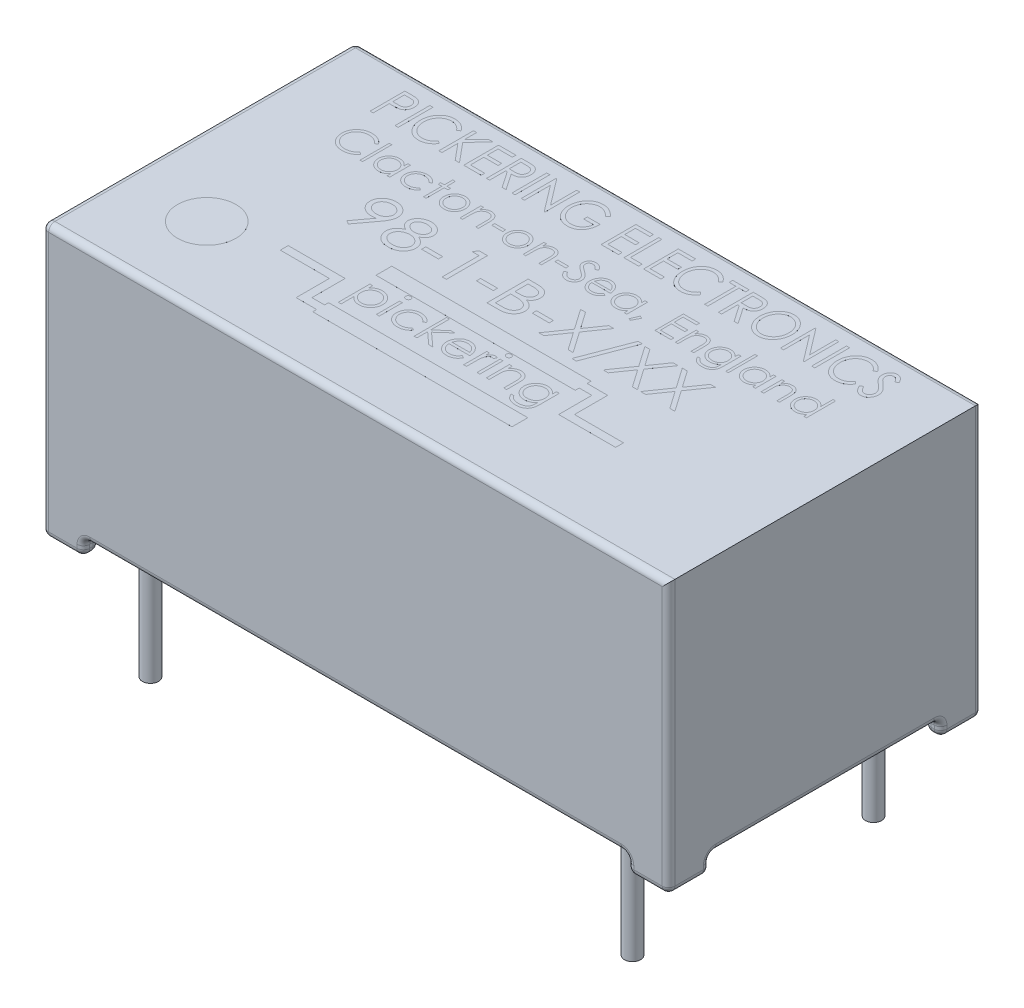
SolidWorks part; units mm, degrees
ref_plane "Front Plane" through (0, 0, 0) normal (0, 0, 1) x (1, 0, 0)
ref_plane "Top Plane" through (0, 0, 0) normal (0, 1, 0) x (1, 0, 0)
ref_plane "Right Plane" through (0, 0, 0) normal (1, 0, 0) x (0, 0, -1)
sketch "Sketch1" plane through (0, 0, 0) normal (0, 1, 0) x (1, 0, 0)
  line L1 (9.9, -4.95) -> (-9.9, -4.95)
  line L2 (9.9, -4.95) -> (9.9, 4.95)
  line L3 (9.9, 4.95) -> (-9.9, 4.95)
  line L4 (-9.9, -4.95) -> (-9.9, 4.95)
  line L5 (9.9, -4.95) -> (-9.9, 4.95) construction
  line L6 (9.9, 4.95) -> (-9.9, -4.95) construction
  point P0 (0, 0)
  dimension "D1" = 9.9
  dimension "D2" = 19.8
extrude "Main Body" add sketch "Sketch1" along normal blind 8.092
sketch "Sketch2" plane through (0, 0, 0) normal (0, -1, 0) x (1, 0, 0)
  line L1 (-9.9, 4.95) -> (-8.6, 4.95)
  line L2 (-9.9, 4.95) -> (-9.9, 3.65)
  line L3 (-9.9, 3.65) -> (-9.4, 3.65)
  line L4 (-8.6, 4.95) -> (-8.6, 4.45)
  line L7 (-8.6, 4.45) -> (-9.4, 4.45)
  line L8 (-9.4, 3.65) -> (-9.4, 4.45)
  dimension "D1" = 1.3
  dimension "D2" = 1.3
  dimension "D3" = 0.5
  dimension "D4" = 0.5
extrude "Foot" add sketch "Sketch2" along normal blind 0.508
mirror "Mirror1" about plane through (0, 0, 0) normal (0, 0, 1) of "Foot"
mirror "Mirror2" about plane through (0, 0, 0) normal (1, 0, 0) of "Mirror1", "Foot"
sketch "Sketch3"
  dimension "D1" = 11.5
  dimension "D2" = 4.15
  dimension "D3" = 1.7
  dimension "D4" = 1.5
  dimension "D5" = 1.9
extrude "Lettering" add sketch "Sketch3" along normal blind 0.0001
sketch "Sketch4"
  dimension "D7" = 1.85
  dimension "D1" = 0.5
  dimension "D2" = 6.3
  dimension "D3" = 6.75
  dimension "D4" = 0.5
  dimension "D5" = 1.5
  dimension "D6" = 1.8
  dimension "D8" = 2.6
  dimension "D9" = 2.6
  dimension "D10" = 0.65
  dimension "D11" = 0.25
  dimension "D12" = 0.25
  dimension "D13" = 1.3
  dimension "D14" = 0.25
  dimension "D15" = 1.8
  dimension "D16" = 0.125
  dimension "D17" = 0.65
  dimension "D18" = 0.125
  dimension "D19" = 0.25
  dimension "D20" = 0.25
  dimension "D21" = 1.3
  dimension "D22" = 0.25
  dimension "D23" = 1.8
extrude "Pickering logo" add sketch "Sketch4" along normal blind 0.0001
sketch "Sketch5" plane through (0, 0, 0) normal (0, -1, 0) x (1, 0, 0)
  line L0 (-8.6, 4.95) -> (8.6, 4.95) construction
  line L2 (-9.9, -3.65) -> (-9.9, 3.65) construction
  circle A0 centre (-7.62, 3.81) radius 0.254
  circle A1 centre (-7.62, -3.81) radius 0.254
  circle A2 centre (-5.08, -3.81) radius 0.254
  dimension "D1" = 0.508
  dimension "D2" = 1.14
  dimension "D3" = 2.28
  dimension "D4" = 2.54
extrude "Pins Left" add sketch "Sketch5" along normal blind 3.808
mirror "Pins Right" about plane through (0, 0, 0) normal (1, 0, 0) of "Pins Left"
fillet "Fillet1" radius 0.2 67 edges at (-9.4, 0, -4.05) (-9, 0, -4.45) (-9, 0, 4.45) (9, 0, 4.45) (9, 0, -4.45) (9.4, 0, -4.05) (9.4, 0, 4.05) (-9.4, 0, 4.05) (-9.4, -0.508, -4.05) (-9, -0.508, -4.45) (-9.9, -0.508, -4.3) (-9.4, -0.254, -3.65) (-9.65, -0.508, -3.65) (-9.9, -0.254, -3.65) (-9.65, 0, -3.65) (-8.6, -0.508, -4.7) (-8.6, -0.254, -4.45) (-8.6, 0, -4.7) (-8.6, -0.254, 4.45) (8.6, -0.254, 4.45) (8.6, 0, 4.7) (8.6, -0.254, -4.45) (8.6, 0, -4.7) (9.9, -0.254, -3.65) (9.4, -0.254, -3.65) (9.65, 0, -3.65) (9.4, -0.254, 3.65) (9.9, -0.254, 3.65) (9.65, 0, 3.65) (9.65, -0.508, 3.65) (9.4, -0.508, 4.05) (9, -0.508, 4.45) (8.6, -0.508, 4.7) (9.9, -0.508, 4.3) (8.6, -0.508, -4.7) (9, -0.508, -4.45) (9.4, -0.508, -4.05) (9.65, -0.508, -3.65) (9.9, -0.508, -4.3) (-9.4, -0.254, 3.65) (-8.6, -0.508, 4.7) (-9, -0.508, 4.45) (-9.4, -0.508, 4.05) (-9.65, -0.508, 3.65) (-9.9, -0.508, 4.3) (0, 8.092, -4.95) (-9.9, 3.792, -4.95) (-9.25, -0.508, -4.95) (-8.6, -0.254, -4.95) (0, 0, -4.95) (8.6, -0.254, -4.95) (9.25, -0.508, -4.95) (9.9, 3.792, -4.95) (0, 8.092, 4.95) (9.9, 3.792, 4.95) (9.25, -0.508, 4.95) (8.6, -0.254, 4.95) (-9.25, -0.508, 4.95) (-9.9, 3.792, 4.95) (9.9, 0, 0) (-9.9, 8.092, 0)
